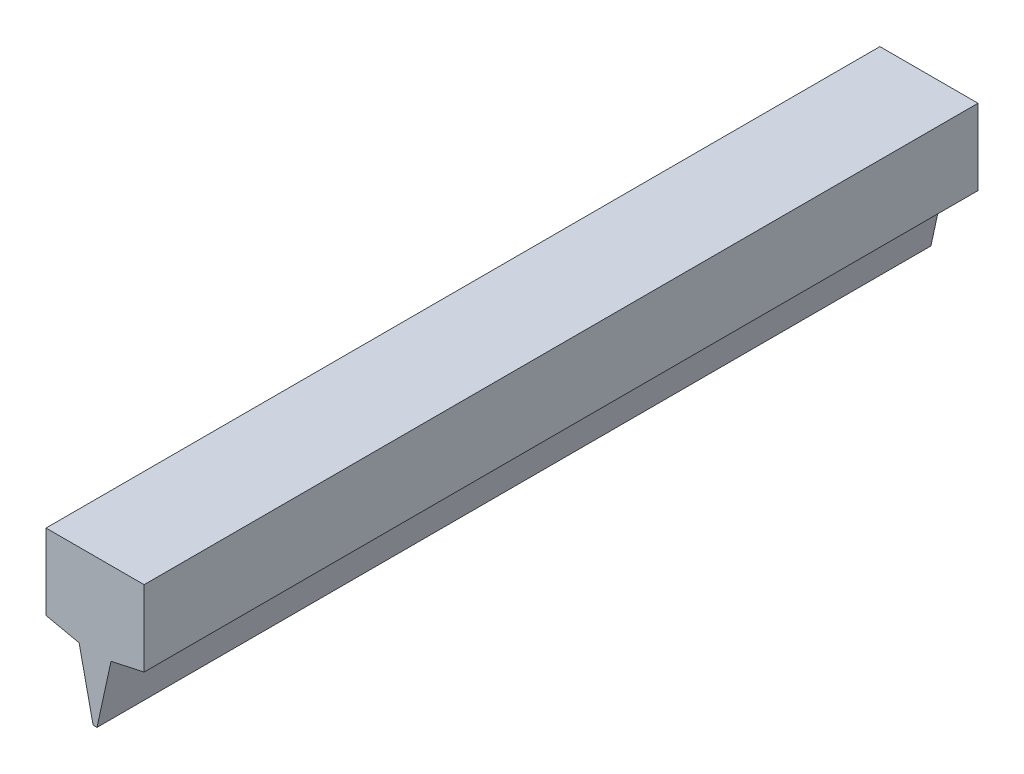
SolidWorks part; units mm, degrees
ref_plane "Front Plane" through (0, 0, 0) normal (0, 0, 1) x (1, 0, 0)
ref_plane "Top Plane" through (0, 0, 0) normal (0, 1, 0) x (1, 0, 0)
ref_plane "Right Plane" through (0, 0, 0) normal (1, 0, 0) x (0, 0, -1)
sketch "Sketch1" plane through (0, 0, 0) normal (0, 0, 1) x (1, 0, 0)
  line L0 (-3.175, 0) -> (3.175, 0)
  line L1 (3.175, 0) -> (3.175, -4.8988)
  line L2 (0.127, -9.525) -> (1.0318, -5.365)
  line L3 (0.127, -9.525) -> (-0.127, -9.525)
  line L4 (1.0318, -5.365) -> (3.175, -4.8988)
  line L5 (-3.175, -4.8988) -> (-3.175, 0)
  line L6 (-3.175, -4.8988) -> (-1.0318, -5.365)
  line L7 (-1.0318, -5.365) -> (-0.127, -9.525)
  dimension "D1" = 6.35
  dimension "D2" = 0.254
  dimension "D3" = 9.525
extrude "Boss-Extrude1" add sketch "Sketch1" along normal blind 53.975
